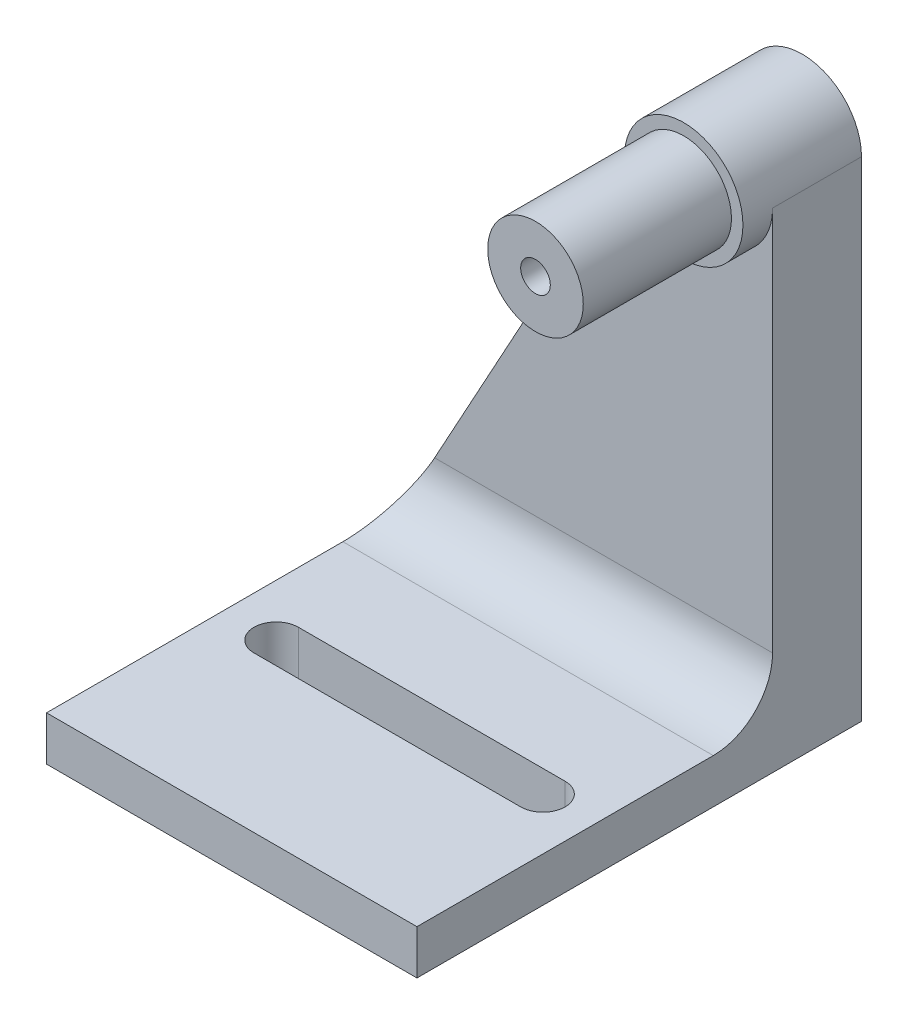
SolidWorks part; units mm, degrees
ref_plane "Plan de face" through (0, 0, 0) normal (0, 0, 1) x (1, 0, 0)
ref_plane "Plan de dessus" through (0, 0, 0) normal (0, 1, 0) x (1, 0, 0)
ref_plane "Plan de droite" through (0, 0, 0) normal (1, 0, 0) x (0, 0, -1)
sketch "Esquisse1" plane through (0, 0, 0) normal (0, 0, 1) x (1, 0, 0)
  line L0 (-25, 0) -> (0, 0)
  line L1 (0, 0) -> (0, 30)
  line L2 (-7.5079, 31.9222) -> (-25, 0)
  line L3 (-25, 0) -> (-25, -3)
  line L4 (-25, -3) -> (0, -3)
  line L5 (0, -3) -> (0, 0)
  line L6 (-25, -3) -> (-25, 0)
  line L7 (0, -3) -> (0, 0)
  arc A0 (0, 30) -> (-7.5079, 31.9222) centre (-4, 30) ccw
  dimension "D3" = 4
  dimension "D1" = 3
  dimension "D2" = 25
  dimension "D4" = 30
extrude "Boss.-Extru.1" add sketch "Esquisse1" along normal blind 6 contours L1 A0 L2 L0 | L4 L5 L0 L3
sketch "Esquisse2" plane through (0, 0, 6) normal (0, 0, 1) x (1, 0, 0)
  circle A0 centre (-4, 30) radius 4
  dimension "D1" = 8
extrude "Boss.-Extru.2" add sketch "Esquisse2" along normal blind 2
sketch "Esquisse3" plane through (0, 0, 8) normal (0, 0, 1) x (1, 0, 0)
  circle A0 centre (-4, 30) radius 3.225
  dimension "D1" = 6.45
extrude "Boss.-Extru.3" add sketch "Esquisse3" along normal blind 10
sketch "Esquisse4" plane through (0, 0, 0) normal (0, 0, -1) x (-1, 0, 0)
  line L1 (0, -3) -> (25, -3)
  line L2 (0, -3) -> (0, 0)
  line L3 (0, 0) -> (25, 0)
  line L4 (25, -3) -> (25, 0)
extrude "Boss.-Extru.4" add sketch "Esquisse4" against normal blind 30
sketch "Esquisse5" plane through (0, 0, 18) normal (0, 0, 1) x (1, 0, 0)
  circle A0 centre (-4, 30) radius 1
  dimension "D1" = 2
extrude "Enlèv. mat.-Extru.1" cut sketch "Esquisse5" against normal blind 32
sketch "Esquisse6" plane through (0, 0, 0) normal (0, 1, 0) x (1, 0, 0)
  line L0 (-25, -18) -> (0, -18) construction
  line L1 (-25, -6) -> (-25, -30) construction
  line L2 (0, -6) -> (0, -30) construction
  line L3 (-21.5, -18) -> (-3.5, -18) construction
  line L4 (-21.5, -16.5) -> (-3.5, -16.5)
  line L5 (-21.5, -19.5) -> (-3.5, -19.5)
  arc A0 (-21.5, -16.5) -> (-21.5, -19.5) centre (-21.5, -18) ccw
  arc A1 (-3.5, -19.5) -> (-3.5, -16.5) centre (-3.5, -18) ccw
  point P8 (-12.5, -18)
  point P14 (-12.5, -18)
  dimension "D2" = 18
  dimension "D1" = 3
extrude "Enlèv. mat.-Extru.2" cut sketch "Esquisse6" against normal blind 32
fillet "Congé1" radius 4 1 edges at (-12.5, 0, 6)
